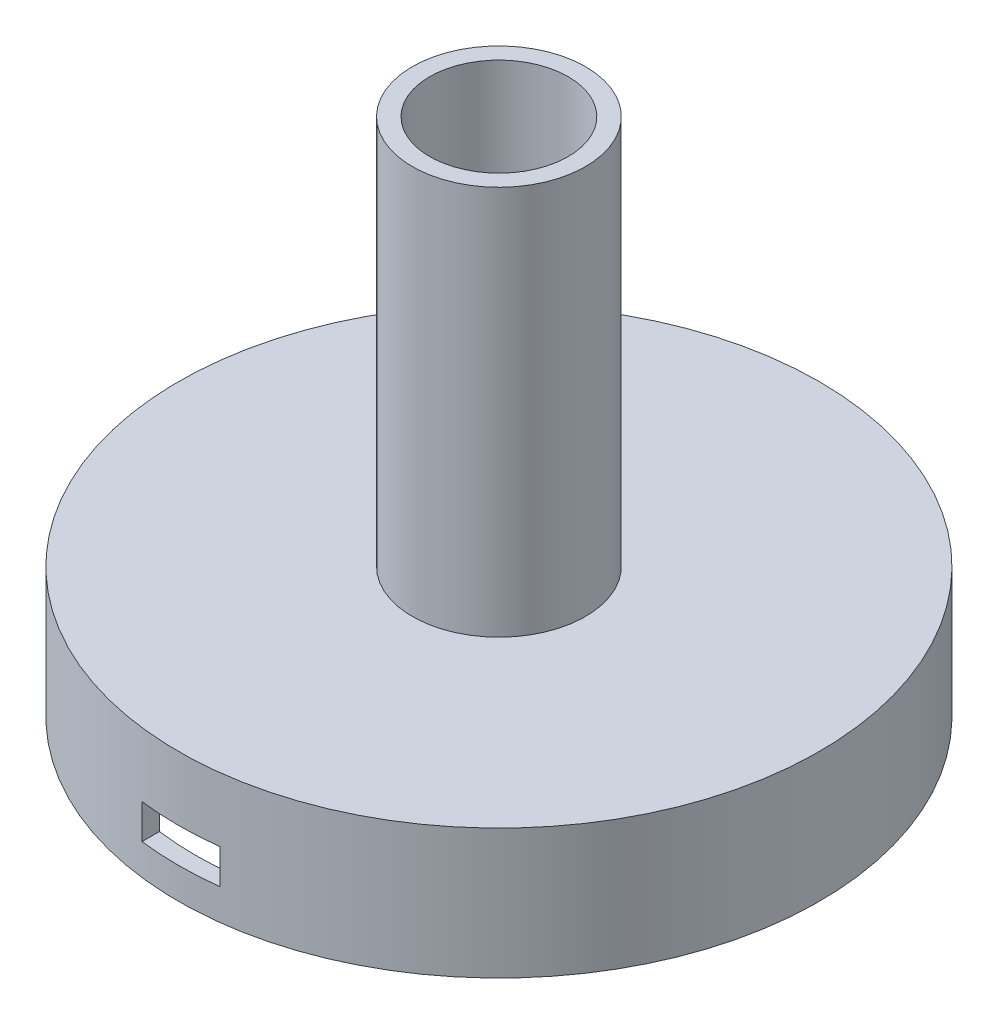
SolidWorks part; units mm, degrees
ref_plane "前视基准面" through (0, 0, 0) normal (0, 0, 1) x (1, 0, 0)
ref_plane "上视基准面" through (0, 0, 0) normal (0, 1, 0) x (1, 0, 0)
ref_plane "右视基准面" through (0, 0, 0) normal (1, 0, 0) x (0, 0, -1)
sketch "草图1" plane through (0, 0, 0) normal (0, 0, 1) x (1, 0, 0)
  line L0 (0, 0) -> (0, 84.6969) construction
  line L2 (-37, 0) -> (-37, 15)
  line L3 (-37, 15) -> (-10, 15)
  line L4 (-10, 15) -> (-10, 60)
revolve "旋转-薄壁2" add sketch "草图1" angle 360 about L0
sketch "草图2" plane through (0, 0, 0) normal (0, 0, 1) x (1, 0, 0)
  line L0 (0, 0) -> (0, 5.6) construction
  line L2 (-4.5, 7.6) -> (4.5, 7.6)
  line L3 (-4.5, 7.6) -> (-4.5, 3.6)
  line L4 (-4.5, 3.6) -> (4.5, 3.6)
  line L5 (4.5, 7.6) -> (4.5, 3.6)
  line L6 (-4.5, 7.6) -> (4.5, 3.6) construction
  line L7 (-4.5, 3.6) -> (4.5, 7.6) construction
extrude "切除-拉伸1" cut sketch "草图2" along normal blind 58
sketch "草图4" plane through (0, 13, 0) normal (0, -1, 0) x (-1, 0, 0)
  line L0 (0, 0) -> (0, -14.3751) construction
  line L1 (-34.9013, -3.115) -> (-34.9013, 1.885)
  line L2 (34.9013, -3.115) -> (27.9013, -3.115)
  line L3 (34.9013, -3.115) -> (34.9013, 1.885)
  line L4 (34.9013, 1.885) -> (27.9013, 1.885)
  line L5 (27.9013, -3.115) -> (27.9013, 1.885)
  line L6 (34.9013, -3.115) -> (27.9013, 1.885) construction
  line L7 (34.9013, 1.885) -> (27.9013, -3.115) construction
  line L12 (-34.9013, 1.885) -> (-27.9013, 1.885)
  line L13 (-27.9013, -3.115) -> (-27.9013, 1.885)
  line L14 (-34.9013, -3.115) -> (-27.9013, -3.115)
  circle A0 centre (-31.4013, -0.615) radius 1.25
  circle A1 centre (31.4013, -0.615) radius 1.25
  point P6 (31.4013, -0.615)
extrude "凸台-拉伸2" add sketch "草图4" along normal blind 11
